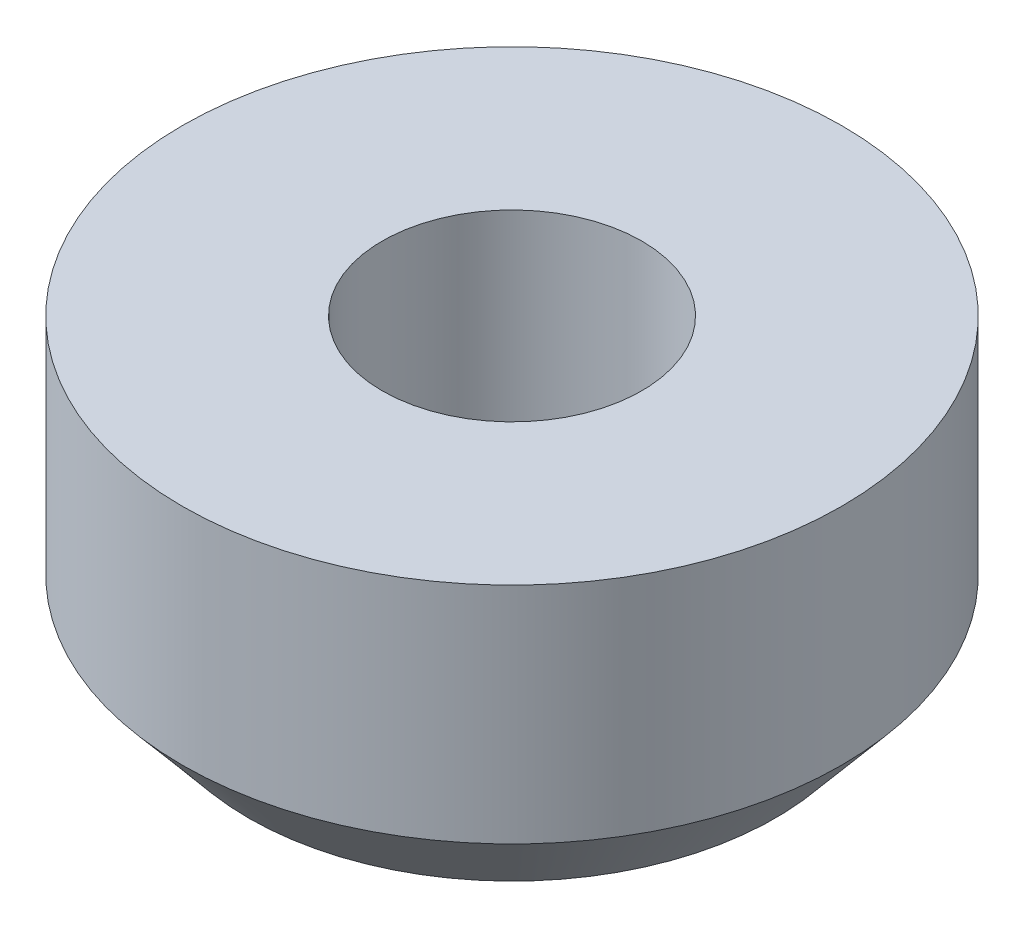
SolidWorks part; units mm, degrees
ref_plane "Front Plane" through (0, 0, 0) normal (0, 0, 1) x (1, 0, 0)
ref_plane "Top Plane" through (0, 0, 0) normal (0, 1, 0) x (1, 0, 0)
ref_plane "Right Plane" through (0, 0, 0) normal (1, 0, 0) x (0, 0, -1)
sketch "Sketch1" plane through (0, 0, 0) normal (0, 1, 0) x (1, 0, 0)
  circle A0 centre (0, 0) radius 6.35
  dimension "D1" = 12.7
extrude "Boss-Extrude1" add sketch "Sketch1" along normal mid plane 5.842
hole_wizard "M6x1.0 Tapped Hole1" positions "Sketch3" profile "Sketch2" tap size "M6x1.0" standard "ANSI Metric"
sketch "Sketch3" plane through (0, -2.921, 0) normal (0, 1, 0) x (1, 0, 0)
  point P0 (0, 0)
sketch "Sketch2" plane through (0, -2.921, 0) normal (1, 0, 0) x (0, 0, -1)
  line L0 (0, 0) -> (0, 5.842)
  line L1 (0, 5.842) -> (2.5, 5.842)
  line L2 (2.5, 5.842) -> (2.5, 0)
  line L5 (2.5, 0) -> (0, 0)
  line L11 (0, -6.35) -> (0, 107.95) construction
  dimension "Thru Tap Drill Dia." = 5
  dimension "Thru Tap Drill Depth" = 5.842
sketch "Sketch4" plane through (0, 2.921, 0) normal (0, 1, 0) x (1, 0, 0)
  line L1 (-6.35, -0.889) -> (6.35, -0.889)
  line L2 (-6.35, -0.889) -> (-6.35, 0.889)
  line L3 (-6.35, 0.889) -> (6.35, 0.889)
  line L4 (6.35, -0.889) -> (6.35, 0.889)
  line L5 (-6.35, -0.889) -> (6.35, 0.889) construction
  line L6 (-6.35, 0.889) -> (6.35, -0.889) construction
  circle A0 centre (0, 0) radius 6.35 construction
  point P0 (0, 0)
  dimension "D1" = 1.778
extrude "Cut-Extrude1" [suppressed] cut sketch "Sketch4" against normal blind 1.27
chamfer "Chamfer1" distance 1.524 angle 40 1 edges at (0, -2.921, 6.35)
